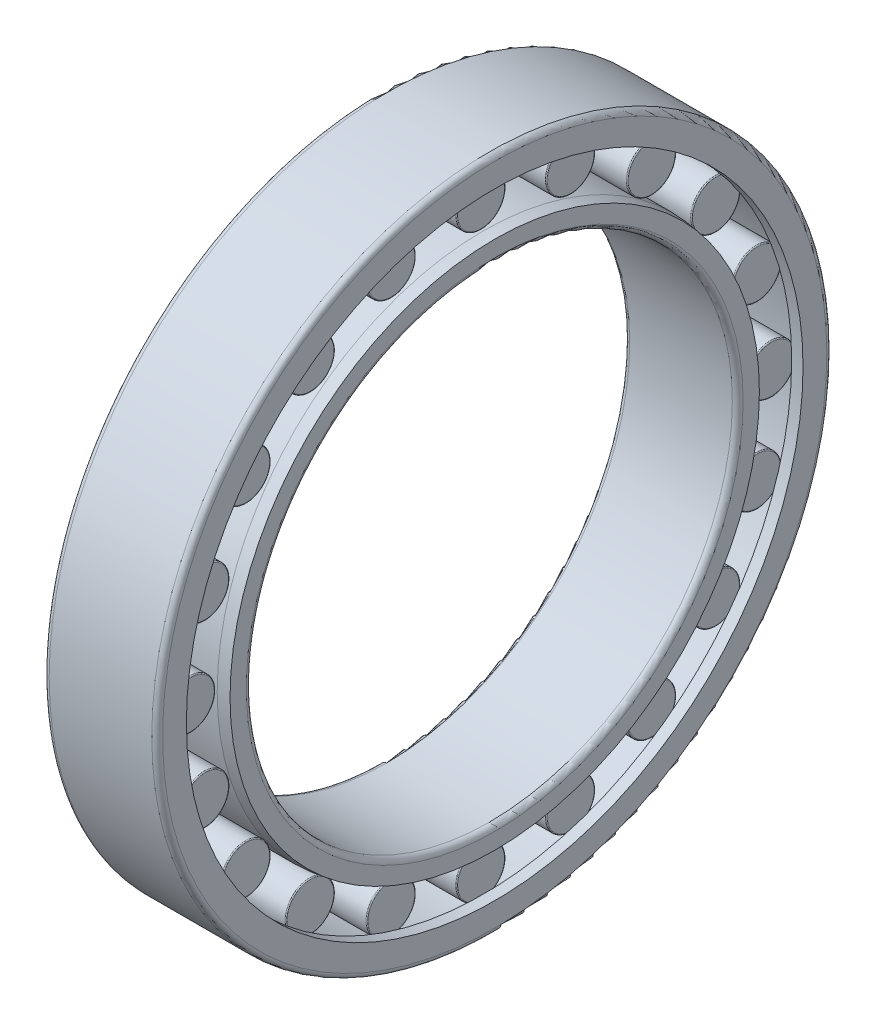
SolidWorks part; units mm, degrees
ref_plane "Plane1" through (0, 0, 0) normal (0, 0, 1) x (1, 0, 0)
ref_plane "Plane2" through (0, 0, 0) normal (0, 1, 0) x (1, 0, 0)
ref_plane "Plane3" through (0, 0, 0) normal (1, 0, 0) x (0, 0, -1)
sketch "Clipboard" plane through (0, 0, 0) normal (0, 0, 1) x (1, 0, 0)
  line L0 (-10, 0) -> (10, 0) construction
  line L1 (0, 0) -> (185.2698, -67.4327)
  line L2 (0, 0) -> (101.017, 36.7672)
  line L3 (0, 0) -> (218.798, -79.636)
  line L4 (0, 0) -> (-22.3471, -0.7804)
sketch "OutRacSke" plane through (0, 0, 0) normal (0, 0, 1) x (1, 0, 0)
  line L0 (-16.8, 114.1887) -> (-21, 114.1887)
  line L1 (-21, 114.1887) -> (-21, 123)
  line L2 (-19, 125) -> (19, 125)
  line L3 (21, 123) -> (21, 114.1888)
  line L4 (21, 114.1888) -> (16.8, 114.1888)
  line L5 (16.8, 114.1888) -> (16.8, 116.42)
  line L6 (16.8, 116.42) -> (-16.8, 116.42)
  line L7 (-16.8, 116.42) -> (-16.8, 114.1887)
  line L8 (-90, 0) -> (90, 0) construction
  arc A0 (-21, 123) -> (-19, 125) centre (-19, 123) cw
  arc A1 (19, 125) -> (21, 123) centre (19, 123) cw
revolve "OuterRace" add sketch "OutRacSke" angle 360 about L8
sketch "RolDetSke" plane through (0, 0, 0) normal (0, 0, 1) x (1, 0, 0)
  line L0 (-15.96, 116.1851) -> (-15.96, 107.5)
  line L1 (-15.96, 107.5) -> (15.96, 107.5)
  line L2 (15.96, 107.5) -> (15.96, 116.1851)
  line L3 (15.5981, 116.547) -> (-15.5981, 116.547)
  line L4 (-33.6, 107.5) -> (33.6, 107.5) construction
  arc A0 (15.96, 116.1851) -> (15.5981, 116.547) centre (15.5981, 116.1851) ccw
  arc A1 (-15.5981, 116.547) -> (-15.96, 116.1851) centre (-15.5981, 116.1851) ccw
revolve "RollerDetailed" add sketch "RolDetSke" angle 360 about L4
ref_axis "Axis1" through (-50, 0, 0) along (1, 0, 0)
sketch "RolSimSke" plane through (0, 101.6, 0) normal (0, 0, 1) x (1, 0, 0)
  line L0 (-15.96, 14.5851) -> (-15.96, -2.7851)
  line L1 (25.4, -101.6) -> (-25.4, -101.6) construction
  line L2 (15.96, -2.7851) -> (15.96, 14.5851)
  line L3 (15.5981, 14.947) -> (-15.5981, 14.947)
  line L5 (15.5981, -3.147) -> (-15.5981, -3.147)
  arc A0 (15.96, 14.5851) -> (15.5981, 14.947) centre (15.5981, 14.5851) ccw
  arc A1 (-15.5981, 14.947) -> (-15.96, 14.5851) centre (-15.5981, 14.5851) ccw
  arc A2 (15.96, -2.7851) -> (15.5981, -3.147) centre (15.5981, -2.7851) cw
  arc A3 (-15.5981, -3.147) -> (-15.96, -2.7851) centre (-15.5981, -2.7851) cw
revolve "RollersSimplified" [suppressed] add sketch "RolSimSke" angle 360 about L1
sketch "InsRacSke" plane through (0, 0, 0) normal (0, 0, 1) x (1, 0, 0)
  line L0 (-16.8, 98.58) -> (-21, 98.0222)
  line L1 (-21, 98.0222) -> (-21, 92)
  line L2 (-19, 90) -> (19, 90)
  line L3 (21, 92) -> (21, 98.0222)
  line L4 (21, 98.0222) -> (16.8, 98.58)
  line L5 (16.8, 98.58) -> (-16.8, 98.58)
  line L6 (-90, 0) -> (90, 0) construction
  arc A0 (-21, 92) -> (-19, 90) centre (-19, 92) ccw
  arc A1 (19, 90) -> (21, 92) centre (19, 92) ccw
revolve "InnerRace" add sketch "InsRacSke" angle 360 about L6
pattern_circular "RollersDetailed" count 20 every 18 about axis through (-50, 0, 0) along (1, 0, 0) of "RollerDetailed"
sketch "CagSpiSke" plane through (0, 0, 0) normal (0, 0, 1) x (1, 0, 0)
  line L0 (18.9, 105.2383) -> (18.9, 109.7618)
  line L1 (18.9, 109.7618) -> (-18.9, 109.7618)
  line L2 (-18.9, 109.7618) -> (-18.9, 105.2383)
  line L3 (-18.9, 105.2383) -> (18.9, 105.2383)
  line L4 (-90, 0) -> (90, 0) construction
revolve "CageSpine" [suppressed] add sketch "CagSpiSke" angle 360 about L4
equation "\"CLdia@Clipboard\" =  ( \"Race_OD@Clipboard\" + \"Race_ID@Clipboard\" )  / 4"
equation "\"Race_OD@OutRacSke\" = \"Race_OD@Clipboard\""
equation "\"halfCylLen@OutRacSke\" = \"Cyl_Len@OutRacSke\" / 2"
equation "\"RolCLRad@RolDetSke\" = \"CLdia@Clipboard\""
equation "\"Roller_diameter@RolDetSke\" =  ( \"Race_OD@Clipboard\" - \"Race_ID@Clipboard\" )  / 2 + .01"
equation "\"Roller_diameter@RolSimSke\" =  ( \"Race_OD@Clipboard\" - \"Race_ID@Clipboard\" )  / 2 + .01"
equation "\"radius@RolDetSke\" = \"Roller_diameter@RolDetSke\" / 50"
equation "\"Length@RolDetSke\" = \"Cyl_Len@OutRacSke\" * .95"
equation "\"halfLength@RolDetSke\" = \"Length@RolDetSke\" / 2"
equation "\"thickness@CagSpiSke\"  = \"Roller_diameter@RolDetSke\" * .25"
equation "\"Cag_IR@CagSpiSke\" =  \"RolCLRad@RolDetSke\" * 2 - \"thickness@CagSpiSke\""
equation "\"Rol_Length@RolSimSke\" = \"Cyl_Len@InsRacSke\" * .95"
equation "\"halfLength@RolSimSke\" = \"Rol_Length@RolSimSke\" / 2"
equation "\"radius@RolSimSke\" = \"radius@RolDetSke\""
equation "\"D1@RolSimSke\" = \"CLdia@Clipboard\" -  ( \"Roller_diameter@RolSimSke\" / 2 ) "
equation "\"Max_count@Clipboard\" = int( 3.14159265 / atn(( \"Roller_diameter@RolDetSke\" / 2) / sqr( \"RolCLRad@RolDetSke\"  *  \"RolCLRad@RolDetSke\" - ( \"Roller_diameter@RolDetSke\" / 2) *  ( \"Roller_diameter@RolDetS"
equation "\"Max_count@Clipboard\" = ((sgn( \"Max_count@Clipboard\" - \"Count@Clipboard\" )-1)*( \"Max_count@Clipboard\" - \"Count@Clipboard\" ))/-2+ \"Count@Clipboard\""
equation "\"Count@RollersDetailed\" = int( \"Show_count@Clipboard\" ) "
equation "\"Count@RollersDetailed\" = ((sgn( \"Count@RollersDetailed\" - \"Max_count@Clipboard\" )-1)*( \"Count@RollersDetailed\" - \"Max_count@Clipboard\" ))/-2+ \"Max_count@Clipboard\""
equation "\"Count@RollersDetailed\" = ((sgn( \"Count@RollersDetailed\" - \"Min_count@Clipboard\" )+1)*( \"Count@RollersDetailed\" - \"Min_count@Clipboard\"))/2 +\"Min_count@Clipboard\""
equation "\"Angle@RollersDetailed\" = 360.0 / \"Max_count@Clipboard\""
equation "\"radius@InsRacSke\" = \"radius@OutRacSke\""
equation "\"groove_dp@InsRacSke\" = \"groove_dp@OutRacSke\" / 4"
equation "\"Width@InsRacSke\" = \"Width@OutRacSke\""
equation "\"halfWidth@OutRacSke\" = \"Width@OutRacSke\" / 2"
equation "\"halfWidth@InsRacSke\" = \"Width@InsRacSke\" / 2"
equation "\"Race_ID@InsRacSke\" = \"Race_ID@Clipboard\""
equation "\"Cyl_Len@InsRacSke\" = \"Cyl_Len@OutRacSke\""
equation "\"Angle@CageSpine\" =  \"Angle@RollersDetailed\" * ( \"Count@RollersDetailed\" -1 + int( \"Count@RollersDetailed\" / \"Max_count@Clipboard\" ) )  + 0.001 -  int( \"Count@RollersDetailed\" / \"Max_count@Clipboard\" "
equation "\"Angle@CageSpine\" =  \"Angle@CageSpine\" * int( \"Min_count@Clipboard\" / 2) + int(1 / \"Min_count@Clipboard\")  * 0.001"
equation "\"width@CagSpiSke\" =   ( \"Width@InsRacSke\" + \"Cyl_Len@InsRacSke\" )  / 2"
equation "\"halfwidth@CagSpiSke\" = \"width@CagSpiSke\" / 2"
